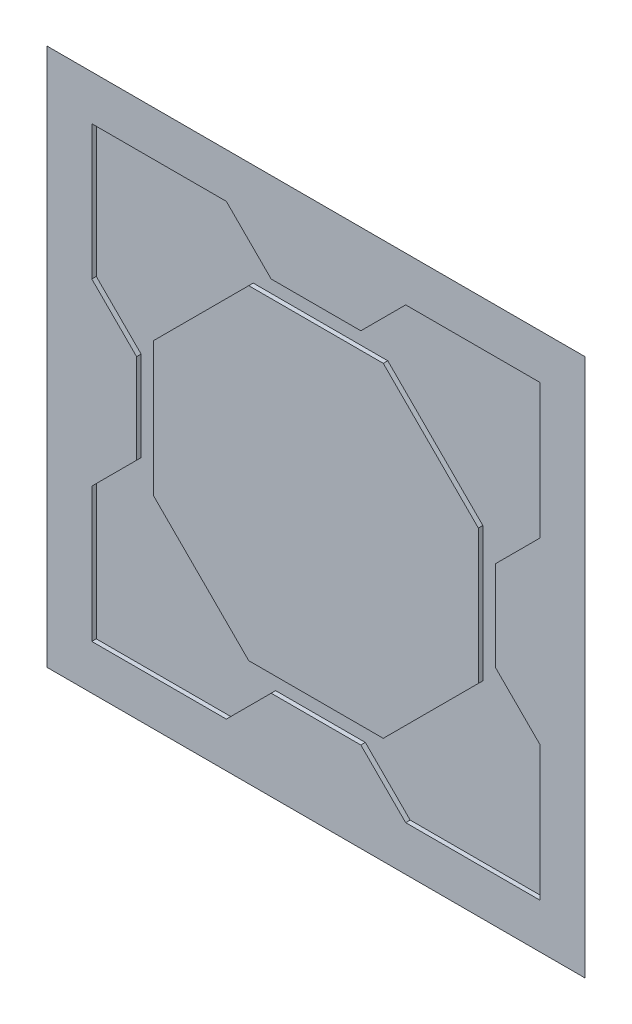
SolidWorks part; units mm, degrees
ref_plane "Front Plane" through (0, 0, 0) normal (0, 0, 1) x (1, 0, 0)
ref_plane "Top Plane" through (0, 0, 0) normal (0, 1, 0) x (1, 0, 0)
ref_plane "Right Plane" through (0, 0, 0) normal (1, 0, 0) x (0, 0, -1)
sketch "Sketch1" plane through (0, 0, 0) normal (0, 0, 1) x (1, 0, 0)
  line L1 (-60, -60) -> (60, -60)
  line L2 (-60, -60) -> (-60, 60)
  line L3 (-60, 60) -> (60, 60)
  line L4 (60, -60) -> (60, 60)
  line L5 (-60, -60) -> (60, 60) construction
  line L6 (-60, 60) -> (60, -60) construction
  point P0 (0, 0)
  dimension "D1" = 120
  dimension "D2" = 120
extrude "Boss-Extrude1" add sketch "Sketch1" along normal blind 10
sketch "Sketch2" plane through (0, 0, 10) normal (0, 0, 1) x (1, 0, 0)
  line L0 (-50, 50) -> (-20, 50)
  line L1 (-20, 50) -> (-10, 40)
  line L2 (-10, 40) -> (10, 40)
  line L3 (10, 40) -> (20, 50)
  line L4 (20, 50) -> (50, 50)
  line L5 (-50, 50) -> (-50, 20)
  line L6 (-50, 20) -> (-40, 10)
  line L7 (-40, 10) -> (-40, -10)
  line L8 (-40, -10) -> (-50, -20)
  line L9 (-50, -20) -> (-50, -50)
  line L10 (-60, 60) -> (-60, -60) construction
  line L11 (60, 60) -> (-60, 60) construction
  line L12 (-50, -50) -> (-20, -50)
  line L13 (-20, -50) -> (-10, -40)
  line L14 (-10, -40) -> (10, -40)
  line L15 (10, -40) -> (20, -50)
  line L16 (20, -50) -> (50, -50)
  line L17 (50, -50) -> (50, -20)
  line L18 (50, -20) -> (40, -10)
  line L19 (40, -10) -> (40, 10)
  line L20 (40, 10) -> (50, 20)
  line L21 (50, 20) -> (50, 50)
  line L23 (-60, -60) -> (60, -60) construction
  line L25 (15, 36.2132) -> (-15, 36.2132)
  line L26 (-15, 36.2132) -> (-36.2132, 15)
  line L27 (-36.2132, 15) -> (-36.2132, -15)
  line L28 (-36.2132, -15) -> (-15, -36.2132)
  line L29 (-15, -36.2132) -> (15, -36.2132)
  line L30 (15, -36.2132) -> (36.2132, -15)
  line L31 (36.2132, -15) -> (36.2132, 15)
  line L32 (36.2132, 15) -> (15, 36.2132)
  circle A0 centre (0, 0) radius 36.2132 construction
  dimension "D1" = 30
  dimension "D2" = 20
  dimension "D3" = 30
  dimension "D4" = 10
  dimension "D5" = 10
  dimension "D6" = 10
  dimension "D7" = 10
  dimension "D8" = 10
  dimension "D9" = 20
  dimension "D10" = 10
  dimension "D11" = 10
  dimension "D12" = 30
extrude "Cut-Extrude1" cut sketch "Sketch2" against normal blind 1
chamfer "Chamfer1" distance 10 angle 45 4 edges at (-60, 0, 0) (0, -60, 0) (60, 0, 0) (0, 60, 0)
sketch "Sketch4" plane through (0, 0, 0) normal (0, 0, -1) x (-1, 0, 0)
  line L0 (-60, -60) -> (-60, 60) construction
  line L1 (-57.5, 40) -> (-52.5, 40)
  line L2 (-57.5, 40) -> (-57.5, 20)
  line L3 (-57.5, 20) -> (-52.5, 20)
  line L4 (-52.5, 40) -> (-52.5, 20)
  line L5 (-57.5, 40) -> (-52.5, 20) construction
  line L6 (-57.5, 20) -> (-52.5, 40) construction
  line L7 (-57.5, -20) -> (-52.5, -20)
  line L8 (-57.5, -20) -> (-57.5, -40)
  line L9 (-57.5, -40) -> (-52.5, -40)
  line L10 (-52.5, -20) -> (-52.5, -40)
  line L11 (-57.5, -20) -> (-52.5, -40) construction
  line L12 (-57.5, -40) -> (-52.5, -20) construction
  line L13 (-60, 60) -> (60, 60) construction
  point P0 (-55, 30)
  point P5 (-55, -30)
  dimension "D1" = 5
  dimension "D2" = 2.5
  dimension "D3" = 20
  dimension "D4" = 40
  dimension "D5" = 20
extrude "Cut-Extrude2" cut sketch "Sketch4" against normal blind 5
sketch "Sketch5" plane through (0, 60, 0) normal (0, 1, 0) x (1, 0, 0)
  line L0 (60, 0) -> (-60, 0) construction
  line L1 (-40, -7.5) -> (-20, -7.5)
  line L2 (-40, -7.5) -> (-40, -2.5)
  line L3 (-40, -2.5) -> (-20, -2.5)
  line L4 (-20, -7.5) -> (-20, -2.5)
  line L5 (20, -7.5) -> (40, -7.5)
  line L6 (20, -7.5) -> (20, -2.5)
  line L7 (20, -2.5) -> (40, -2.5)
  line L8 (40, -7.5) -> (40, -2.5)
  line L9 (-60, -10) -> (-60, 0) construction
  line L10 (60, -10) -> (-60, -10) construction
  dimension "D1" = 20
  dimension "D2" = 5
  dimension "D3" = 2.5
  dimension "D4" = 20
  dimension "D5" = 40
  dimension "D6" = 20
  dimension "D7" = 2.5
  dimension "D8" = 5
extrude "Boss-Extrude3" add sketch "Sketch5" along normal blind 5
sketch "Sketch6" plane through (0, -60, 0) normal (0, -1, 0) x (-1, 0, 0)
  line L0 (-60, -10) -> (-60, 0) construction
  line L1 (40, -2.5) -> (20, -2.5)
  line L2 (40, -2.5) -> (40, -7.5)
  line L3 (40, -7.5) -> (20, -7.5)
  line L4 (20, -2.5) -> (20, -7.5)
  line L5 (-20, -7.5) -> (-40, -7.5)
  line L6 (-20, -7.5) -> (-20, -2.5)
  line L7 (-20, -2.5) -> (-40, -2.5)
  line L8 (-40, -7.5) -> (-40, -2.5)
  line L9 (60, 0) -> (-60, 0) construction
  dimension "D1" = 20
  dimension "D2" = 40
  dimension "D3" = 20
  dimension "D4" = 20
  dimension "D5" = 2.5
  dimension "D6" = 5
  dimension "D7" = 5
  dimension "D8" = 2.5
extrude "Boss-Extrude4" add sketch "Sketch6" along normal blind 5
sketch "Sketch7" plane through (0, 0, 10) normal (0, 0, 1) x (1, 0, 0)
  line L0 (-60, -60) -> (60, -60) construction
  line L1 (-60, 60) -> (-50, 60)
  line L2 (-60, 60) -> (-60, -60)
  line L3 (-60, -60) -> (-50, -60)
  line L4 (-50, 60) -> (-50, -60)
  dimension "D1" = 120
  dimension "D2" = 10
extrude "Cut-Extrude4" cut sketch "Sketch7" along normal blind 5 and the other way through all
sketch "Sketch8" plane through (-50, 0, 0) normal (-1, 0, 0) x (0, 0, 1)
  line L0 (0, 60) -> (10, 60) construction
  line L1 (2.5, 40) -> (7.5, 40)
  line L2 (2.5, 40) -> (2.5, 20)
  line L3 (2.5, 20) -> (7.5, 20)
  line L4 (7.5, 40) -> (7.5, 20)
  line L5 (2.5, -20) -> (7.5, -20)
  line L6 (2.5, -20) -> (2.5, -40)
  line L7 (2.5, -40) -> (7.5, -40)
  line L8 (7.5, -20) -> (7.5, -40)
  line L9 (0, -60) -> (0, 60) construction
  dimension "D1" = 20
  dimension "D2" = 20
  dimension "D3" = 40
  dimension "D4" = 20
  dimension "D5" = 2.5
  dimension "D6" = 5
  dimension "D7" = 2.5
  dimension "D8" = 5
extrude "Boss-Extrude5" add sketch "Sketch8" along normal blind 5
sketch "Sketch11" plane through (0, 0, 7.5) normal (0, 0, 1) x (1, 0, 0)
  line L0 (40, 60) -> (40, 65)
  line L1 (40, 65) -> (20, 65)
  line L2 (20, 65) -> (20, 60)
  line L3 (20, 60) -> (20.2, 60)
  line L4 (20, 60) -> (40, 60) construction
  line L5 (20.2, 60) -> (20.2, 64.8)
  line L6 (20.2, 64.8) -> (39.8, 64.8)
  line L7 (39.8, 64.8) -> (39.8, 60)
  line L8 (39.8, 60) -> (40, 60)
  line L9 (-40, 60) -> (-40, 65)
  line L10 (-40, 65) -> (-40, 60) construction
  line L11 (60, 60) -> (-50, 60) construction
  line L12 (-40, 65) -> (-20, 65)
  line L13 (-20, 65) -> (-20, 60)
  line L14 (-20, 60) -> (-20.2, 60)
  line L15 (-20.2, 60) -> (-20.2, 64.8)
  line L16 (-20.2, 64.8) -> (-39.8, 64.8)
  line L17 (-39.8, 64.8) -> (-39.8, 60)
  line L18 (-39.8, 60) -> (-40, 60)
  line L19 (-50, 40) -> (-55, 40)
  line L20 (-55, 40) -> (-55, 20)
  line L21 (-55, 20) -> (-50, 20)
  line L22 (-50, 20) -> (-50, 20.2)
  line L23 (-50, 20) -> (-50, 40) construction
  line L24 (-50, 20.2) -> (-54.8, 20.2)
  line L25 (-54.8, 20.2) -> (-54.8, 39.8)
  line L26 (-54.8, 39.8) -> (-50, 39.8)
  line L27 (-50, 39.8) -> (-50, 40)
  line L28 (-50, -20) -> (-55, -20)
  line L29 (-55, -20) -> (-55, -40)
  line L30 (-55, -40) -> (-50, -40)
  line L31 (-55, -40) -> (-50, -40) construction
  line L32 (-50, -20) -> (-50, -50) construction
  line L33 (-50, -40) -> (-50, -39.8)
  line L34 (-50, -39.8) -> (-54.8, -39.8)
  line L35 (-54.8, -39.8) -> (-54.8, -20.2)
  line L36 (-54.8, -20.2) -> (-50, -20.2)
  line L37 (-50, -20.2) -> (-50, -20)
  line L38 (-20, -60) -> (-20, -65)
  line L39 (-20, -65) -> (-40, -65)
  line L40 (-40, -65) -> (-40, -60)
  line L41 (-40, -60) -> (-39.8, -60)
  line L42 (-20, -60) -> (-40, -60) construction
  line L43 (-39.8, -60) -> (-39.8, -64.8)
  line L44 (-39.8, -64.8) -> (-20.2, -64.8)
  line L45 (-20.2, -64.8) -> (-20.2, -60)
  line L46 (-20.2, -60) -> (-20, -60)
  line L47 (20, -60) -> (20, -65)
  line L48 (20, -65) -> (40, -65)
  line L49 (40, -65) -> (40, -60)
  line L50 (40, -60) -> (39.8, -60)
  line L51 (40, -60) -> (20, -60) construction
  line L52 (39.8, -60) -> (39.8, -64.8)
  line L53 (39.8, -64.8) -> (20.2, -64.8)
  line L54 (20.2, -64.8) -> (20.2, -60)
  line L55 (20.2, -60) -> (20, -60)
  point P86 (-40, -62.5)
  dimension "D1" = 0.2
  dimension "D2" = 0.2
  dimension "D3" = 0.2
  dimension "D4" = 0.2
  dimension "D5" = 0.2
  dimension "D6" = 0.2
  dimension "D7" = 0.2
  dimension "D8" = 0.2
  dimension "D9" = 0.2
  dimension "D10" = 0.2
  dimension "D11" = 0.2
  dimension "D12" = 0.2
  dimension "D13" = 0.2
  dimension "D14" = 0.2
  dimension "D15" = 0.2
  dimension "D16" = 0.2
  dimension "D17" = 0.2
  dimension "D18" = 0.2
extrude "Cut-Extrude5" cut sketch "Sketch11" against normal through all both and the other way through all
sketch "Sketch12" plane through (-50, 0, 0) normal (-1, 0, 0) x (0, 0, 1)
  line L0 (2.5, 60) -> (2.5, 64.8)
  line L1 (2.5, 64.8) -> (2.7, 64.8)
  line L2 (7.5, 64.8) -> (7.5, 60)
  line L3 (7.5, 60) -> (7.3, 60)
  line L4 (0, 60) -> (10, 60) construction
  line L5 (7.3, 60) -> (7.3, 64.8)
  line L6 (7.5, 64.8) -> (7.3, 64.8)
  line L7 (2.5, 60) -> (7.5, 60) construction
  line L8 (2.7, 60) -> (2.7, 64.8)
  line L9 (2.7, -60) -> (2.5, -60)
  line L10 (2.5, -60) -> (7.5, -60) construction
  line L11 (2.5, -60) -> (2.5, -64.8)
  line L12 (2.5, -64.8) -> (2.7, -64.8)
  line L13 (2.5, -64.8) -> (7.5, -64.8) construction
  line L14 (2.7, -64.8) -> (2.7, -60)
  line L15 (7.5, -60) -> (7.5, -64.8)
  line L16 (7.5, -64.8) -> (7.3, -64.8)
  line L17 (7.3, -64.8) -> (7.3, -60)
  line L18 (0, -60) -> (10, -60) construction
  line L19 (7.3, -60) -> (7.5, -60)
  line L20 (2.5, 60) -> (2.7, 60)
  dimension "D1" = 0.2
  dimension "D2" = 0.2
  dimension "D3" = 0.2
  dimension "D4" = 0.2
extrude "Cut-Extrude6" cut sketch "Sketch12" against normal through all
sketch "Sketch13" plane through (0, 39.8, 0) normal (0, 1, 0) x (1, 0, 0)
  line L0 (-50, -2.5) -> (-54.8, -2.5)
  line L1 (-54.8, -2.5) -> (-50, -2.5) construction
  line L2 (-50, -2.5) -> (-50, -7.5) construction
  line L3 (-54.8, -2.5) -> (-54.8, -2.7)
  line L4 (-54.8, -2.5) -> (-54.8, -7.5) construction
  line L5 (-54.8, -2.7) -> (-50, -2.7)
  line L6 (-50, -2.7) -> (-50, -2.5)
  line L7 (-54.8, -7.5) -> (-54.8, -7.3)
  line L8 (-54.8, -7.3) -> (-50, -7.3)
  line L9 (-50, -7.3) -> (-50, -7.5)
  line L10 (-50, -7.5) -> (-54.8, -7.5) construction
  line L11 (-50, -7.5) -> (-54.8, -7.5)
  point P15 (-52.4, -2.7)
  dimension "D1" = 0.2
  dimension "D2" = 0.2
extrude "Cut-Extrude7" cut sketch "Sketch13" against normal through all
